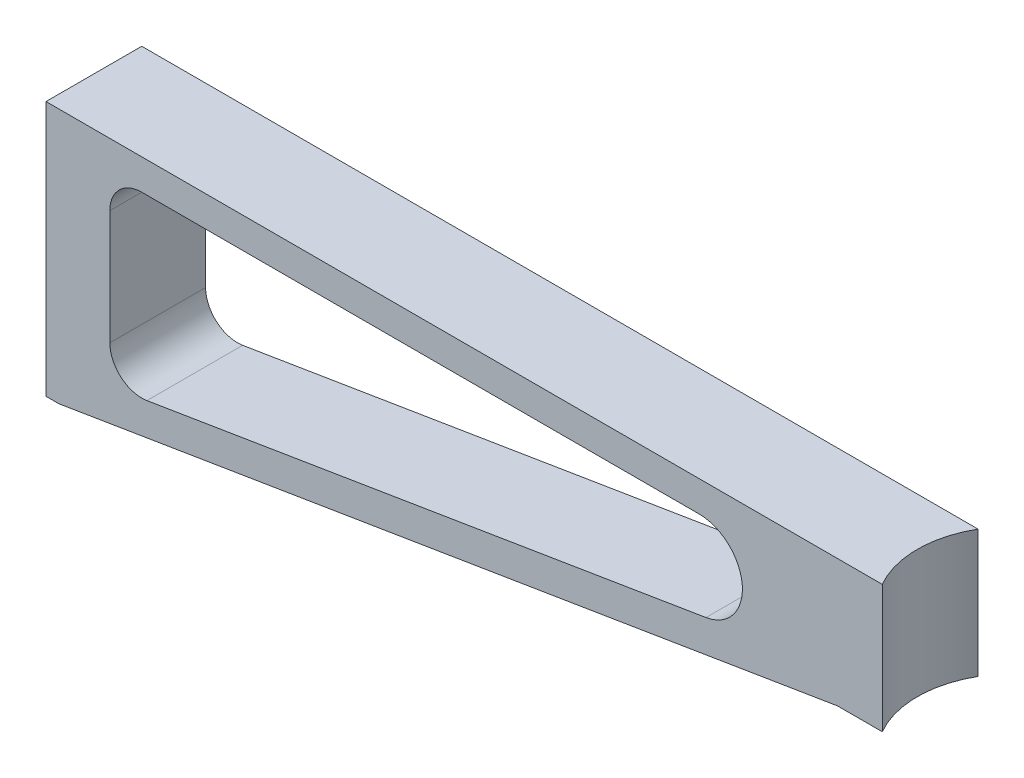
SolidWorks part; units mm, degrees
ref_plane "Front Plane" through (0, 0, 0) normal (0, 0, 1) x (1, 0, 0)
ref_plane "Top Plane" through (0, 0, 0) normal (0, 1, 0) x (1, 0, 0)
ref_plane "Right Plane" through (0, 0, 0) normal (1, 0, 0) x (0, 0, -1)
sketch "Sketch1" plane through (0, 0, 0) normal (0, 0, 1) x (1, 0, 0)
  line L0 (-91.44, 0) -> (-91.44, -25.4)
  line L1 (-91.44, -25.4) -> (-90.17, -25.4)
  line L2 (-12.7, -12.7) -> (0, -12.7)
  line L3 (0, -12.7) -> (0, 0)
  line L4 (0, 0) -> (-91.44, 0)
  line L5 (-12.7, -12.7) -> (-90.17, -25.4)
  line L6 (-85.09, -6.223) -> (-85.09, -17.612)
  line L7 (-81.4014, -20.7451) -> (-25.7815, -11.6271)
  line L8 (-26.48, -3.048) -> (-81.915, -3.048)
  line L9 (-91.44, 0) -> (-91.44, -538.48) construction
  arc A0 (-85.09, -6.223) -> (-81.915, -3.048) centre (-81.915, -6.223) cw
  arc A1 (-85.09, -17.612) -> (-81.4014, -20.7451) centre (-81.915, -17.612) ccw
  arc A2 (-25.7815, -11.6271) -> (-26.48, -3.048) centre (-26.48, -7.366) ccw
  dimension "D9" = 3.175
  dimension "D10" = 4.318
  dimension "D1" = 25.4
  dimension "D3" = 3.048
  dimension "D4" = 3.175
  dimension "D5" = 6.35
  dimension "D6" = 1.27
  dimension "D7" = 12.7
  dimension "D8" = 12.7
extrude "Boss-Extrude1" add sketch "Sketch1" along normal mid plane 9.525
sketch "Sketch2" plane through (0, 0, 0) normal (0, 1, 0) x (1, 0, 0)
  circle A0 centre (0, 0) radius 9.525
  dimension "D1" = 19.05
extrude "Cut-Extrude1" cut sketch "Sketch2" against normal through all
